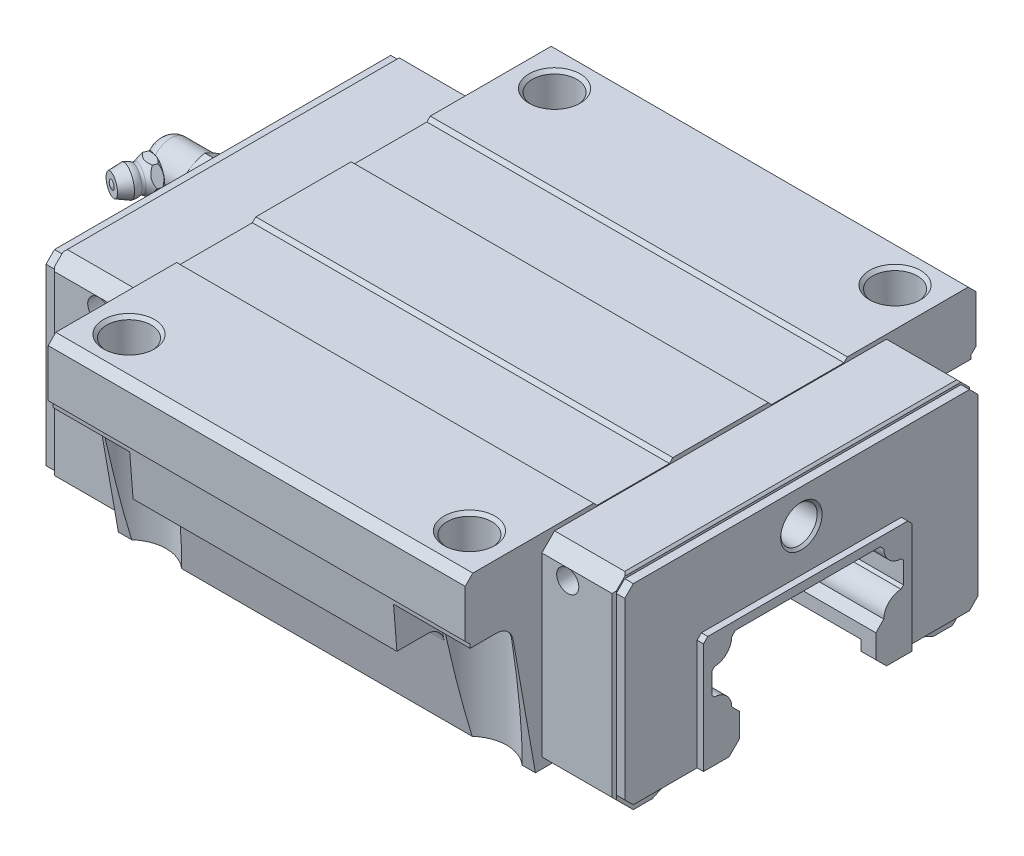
SolidWorks part; units mm, degrees
ref_plane "Front Plane" through (0, 0, 0) normal (0, 0, 1) x (1, 0, 0)
ref_plane "Top Plane" through (0, 0, 0) normal (0, 1, 0) x (1, 0, 0)
ref_plane "Right Plane" through (0, 0, 0) normal (1, 0, 0) x (0, 0, -1)
imported_body "HSR45C1SS-570L_G22-5_0_B-PT18_215-5_0_0_0_1.stp-1/_HSR45CSSB-PT1_81 Slider-1.stp-1-solid1"
imported_body "HSR45C1SS-570L_G22-5_0_B-PT18_215-5_0_0_0_1.stp-1/_hsr_ftht_B-PT1_8_grease_nipple_joint.stp-1-solid1"
move or copy body "Body-Move/Copy1" bodies to move or copy 104 103 copy no translate (-262.5, 0, 0)
